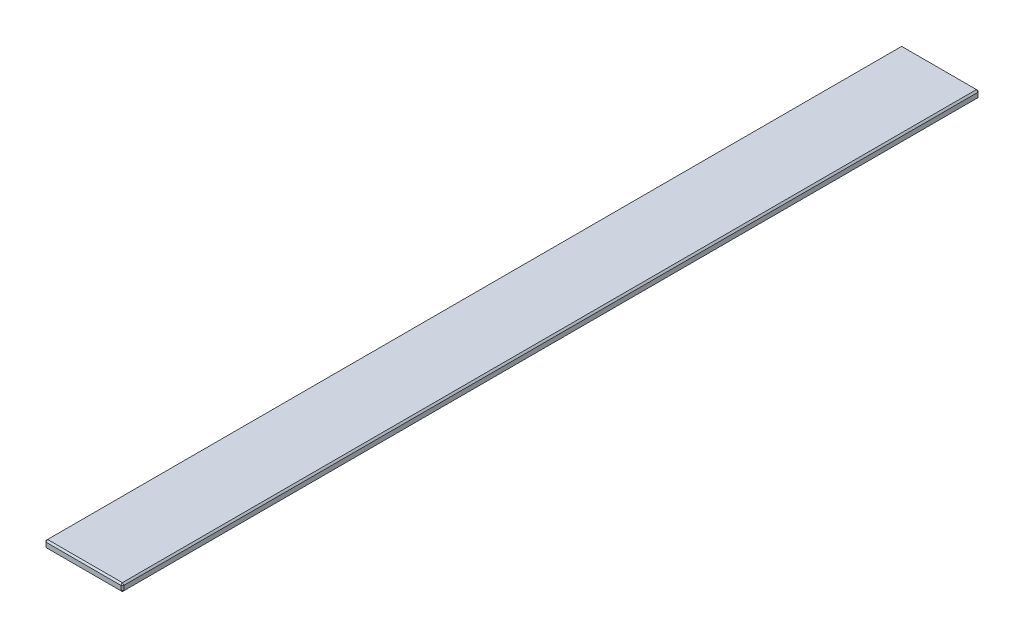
SolidWorks part; units mm, degrees
ref_plane "Plan de face" through (0, 0, 0) normal (0, 0, 1) x (1, 0, 0)
ref_plane "Plan de dessus" through (0, 0, 0) normal (0, 1, 0) x (1, 0, 0)
ref_plane "Plan de droite" through (0, 0, 0) normal (1, 0, 0) x (0, 0, -1)
sketch "Esquisse1" plane through (0, 0, 0) normal (0, 0, 1) x (1, 0, 0)
  line L0 (50, -5) -> (-50, 5) construction
  line L2 (50, -5) -> (-50, -5)
  line L3 (50, -5) -> (50, 5)
  line L4 (50, 5) -> (-50, 5)
  line L5 (-50, -5) -> (-50, 5)
  dimension "D1" = 10
  dimension "D2" = 100
extrude "Boss.-Extru.1" add sketch "Esquisse1" along normal mid plane 1100
chamfer "Chanfrein1" distance 2 angle 45 12 edges at (-50, 0, -550) (50, 0, -550) (-50, -5, 0) (0, -5, -550) (50, -5, 0) (0, -5, 550) (-50, 0, 550) (50, 0, 550) (50, 5, 0) (0, 5, 550) (-50, 5, 0) (0, 5, -550)
